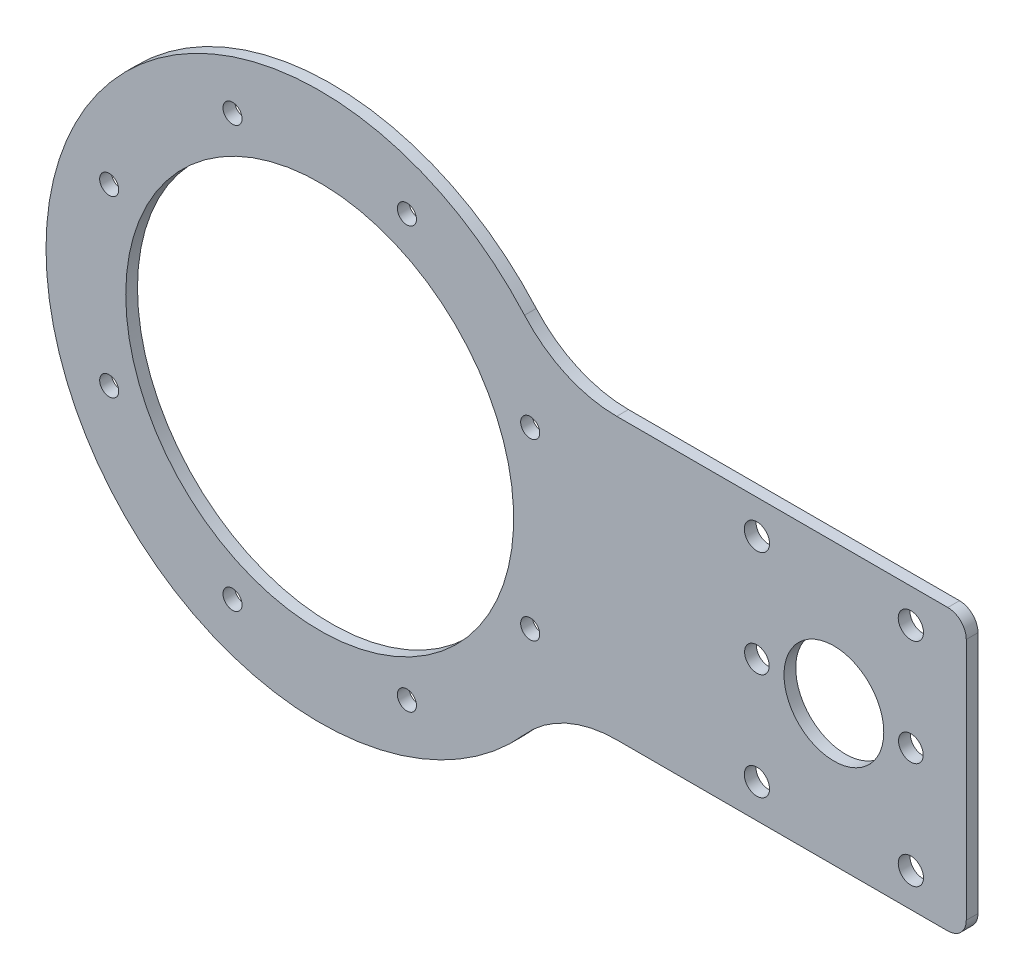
SolidWorks part; units mm, degrees
ref_plane "Front Plane" through (0, 0, 0) normal (1, 0, 0) x (0, 1, 0)
ref_plane "Top Plane" through (0, 0, 0) normal (0, 0, 1) x (0, 1, 0)
ref_plane "Right Plane" through (0, 0, 0) normal (0, 1, 0) x (-1, 0, 0)
sketch "Sketch1" plane through (0, 0, 0) normal (0, 0, 1) x (0, 1, 0)
  line L2 (-22.75, -38.1869) -> (-22.75, -105)
  line L5 (-34.1835, 14.1593) -> (0, 0) construction
  line L9 (17.25, -71) -> (17.25, -96) construction
  line L10 (-22.75, -105) -> (22.75, -105)
  line L11 (22.75, -38.1869) -> (22.75, -105)
  line L12 (0, 0) -> (-31.5, 0) construction
  line L13 (17.25, -96) -> (-17.25, -96) construction
  arc A1 (22.75, -38.1869) -> (-22.75, -38.1869) centre (0, 0) ccw
  circle A6 centre (0, 0) radius 31.5
  circle A7 centre (-34.1835, 14.1593) radius 1.55
  circle A8 centre (-14.1593, 34.1835) radius 1.55
  circle A9 centre (14.1593, 34.1835) radius 1.55
  circle A10 centre (34.1835, 14.1593) radius 1.55
  circle A11 centre (34.1835, -14.1593) radius 1.55
  circle A12 centre (14.1593, -34.1835) radius 1.55
  circle A13 centre (-14.1593, -34.1835) radius 1.55
  circle A14 centre (-34.1835, -14.1593) radius 1.55
  circle A32 centre (-17.25, -96) radius 2.05
  circle A33 centre (17.25, -96) radius 2.05
  circle A34 centre (-17.25, -71) radius 2.05
  circle A35 centre (17.25, -71) radius 2.05
  point P10 (0, -105)
  point P35 (0, -96)
  dimension "D2" = 88.9
  dimension "D5" = 34.5
  dimension "D6" = 4.1
  dimension "D7" = 63
  dimension "D8" = 3.1
  dimension "D4" = 25
  dimension "D13" = 9
  dimension "D3" = 105
  dimension "D9" = 37
  dimension "D11" = 22.5
  dimension "D12" = 45.5
  dimension "D10" = 8
extrude "Boss-Extrude1" add sketch "Sketch1" along normal blind 1.905
fillet "Fillet1" radius 20 2 edges at (38.1869, 22.75, 0.9525) (38.1869, -22.75, 0.9525)
fillet "Fillet2" radius 3 2 edges at (105, 22.75, 0.9525) (105, -22.75, 0.9525)
sketch "Sketch2" plane through (0, 0, 1.905) normal (0, 0, 1) x (1, 0, 0)
  line L0 (71, 17.25) -> (71, -17.25) construction
  line L1 (96, 17.25) -> (96, -17.25) construction
  circle A0 centre (71, 0) radius 2
  circle A1 centre (96, 0) radius 2
  dimension "D1" = 4
extrude "Cut-Extrude1" cut sketch "Sketch2" against normal through all
sketch "Sketch3" plane through (0, 0, 1.905) normal (0, 0, 1) x (1, 0, 0)
  line L0 (71, 0) -> (96, 0) construction
  circle A0 centre (83.5, 0) radius 8.1
  dimension "D1" = 16.2
extrude "Cut-Extrude2" cut sketch "Sketch3" against normal through all
